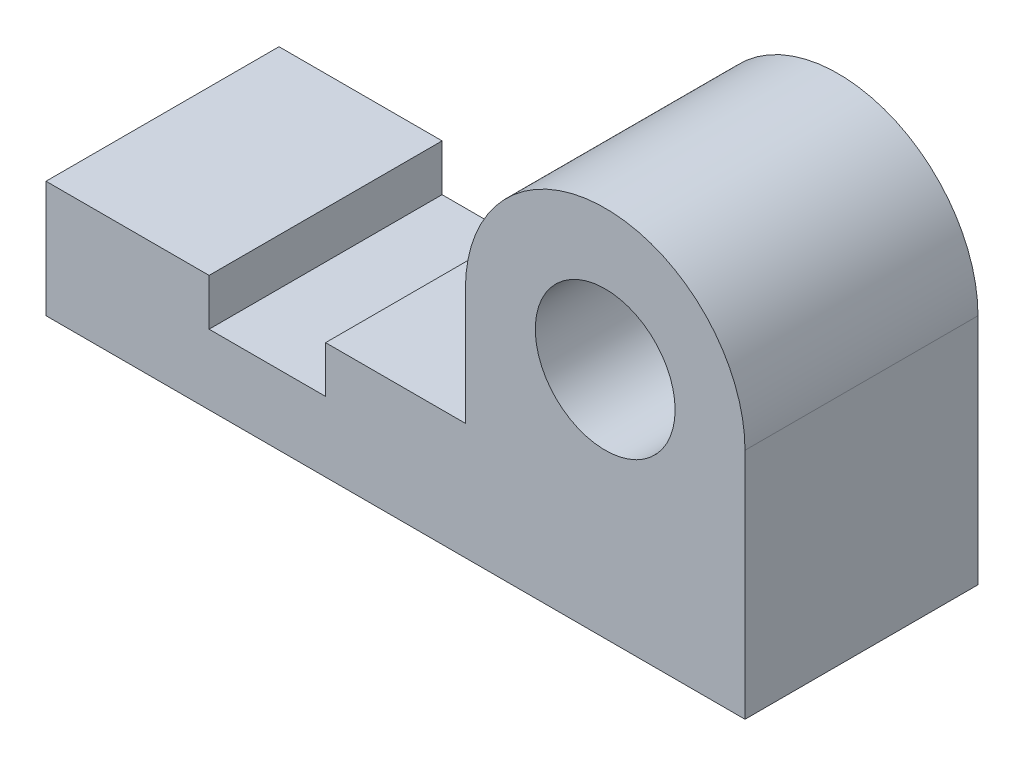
SolidWorks part; units mm, degrees
ref_plane "Front Plane" through (0, 0, 0) normal (0, 0, 1) x (1, 0, 0)
ref_plane "Top Plane" through (0, 0, 0) normal (0, 1, 0) x (1, 0, 0)
ref_plane "Right Plane" through (0, 0, 0) normal (1, 0, 0) x (0, 0, -1)
sketch "Sketch1" plane through (0, 0, 0) normal (0, 0, 1) x (1, 0, 0)
  line L0 (0, 0) -> (300, 0)
  line L1 (300, 0) -> (300, 100)
  line L2 (180, 100) -> (180, 50)
  line L3 (180, 50) -> (120, 50)
  line L4 (120, 50) -> (120, 30)
  line L5 (120, 30) -> (70, 30)
  line L6 (70, 30) -> (70, 50)
  line L7 (70, 50) -> (0, 50)
  line L8 (0, 50) -> (0, 0)
  arc A0 (300, 100) -> (180, 100) centre (240, 100) ccw
  circle A1 centre (240, 100) radius 30
extrude "Boss-Extrude1" add sketch "Sketch1" along normal blind 100
equation "\"Length\"= \"D1@Sketch1\"'Length of the model"
equation "\"D2@Sketch1\" = \"D1@Sketch1\" / 5'Radius"
equation "\"D3@Sketch1\" = \"D1@Sketch1\" / 5'Diameter"
equation "\"D4@Sketch1\" = \"D1@Sketch1\" / 6'Height"
equation "\"D5@Sketch1\" = \"D1@Sketch1\" / 3'Hole location"
equation "\"D6@Sketch1\" = \"D1@Sketch1\" / 30 * 7'Slot location"
equation "\"D7@Sketch1\" = \"D1@Sketch1\" / 6'Slot"
equation "\"D8@Sketch1\"= \"D1@Sketch1\" / 10 'Slot depth"
equation "\"D1@Boss-Extrude1\"= \"D1@Sketch1\" / 3'Extrude"
